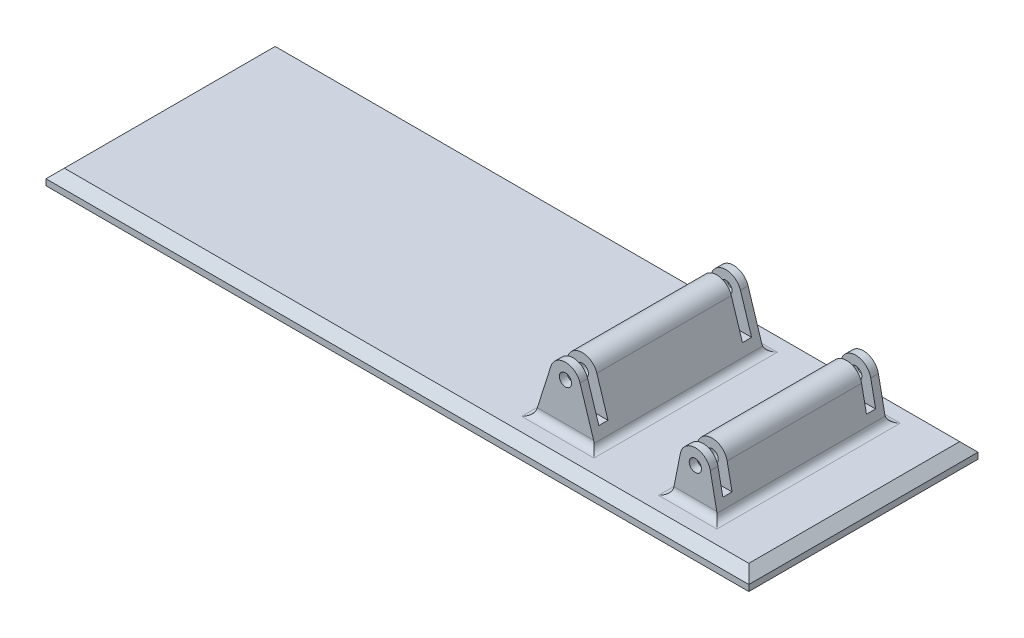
SolidWorks part; units mm, degrees
ref_plane "Front Plane" through (0, 0, 0) normal (0, 0, 1) x (1, 0, 0)
ref_plane "Top Plane" through (0, 0, 0) normal (0, 1, 0) x (1, 0, 0)
ref_plane "Right Plane" through (0, 0, 0) normal (1, 0, 0) x (0, 0, -1)
sketch "Sketch1" plane through (0, 0, 0) normal (0, 1, 0) x (1, 0, 0)
  line L0 (203.2, 69.85) -> (241.3, 69.85)
  line L1 (-292.1, -95.25) -> (292.1, -95.25)
  line L2 (-292.1, -95.25) -> (-292.1, 95.25)
  line L3 (-292.1, 95.25) -> (292.1, 95.25)
  line L4 (292.1, -95.25) -> (292.1, 95.25)
  line L5 (-292.1, -95.25) -> (292.1, 95.25) construction
  line L6 (-292.1, 95.25) -> (292.1, -95.25) construction
  line L7 (88.9, 69.85) -> (139.7, 69.85)
  line L8 (88.9, 69.85) -> (88.9, -69.85)
  line L9 (88.9, -69.85) -> (139.7, -69.85)
  line L10 (139.7, 69.85) -> (139.7, -69.85)
  line L11 (203.2, 69.85) -> (203.2, -69.85)
  line L12 (203.2, -69.85) -> (241.3, -69.85)
  line L13 (241.3, 69.85) -> (241.3, -69.85)
  point P0 (0, 0)
  dimension "D1" = 190.5
  dimension "D2" = 584.2
  dimension "D3" = 152.4
  dimension "D4" = 25.4
  dimension "D5" = 25.4
  dimension "D6" = 50.8
  dimension "D7" = 63.5
  dimension "D8" = 38.1
extrude "Base" add sketch "Sketch1" against normal blind 12.7 contours L1 L4 L3 L2 L7 L10 L9 L8 | L10 L7 L8 L9 | L13 L0 L11 L12
chamfer "Edge Chamfer" distance 7.62 angle 45 4 edges at (0, 0, -95.25) (292.1, 0, 0) (0, 0, 95.25) (-292.1, 0, 0)
sketch "Sketch2" plane through (0, 0, 0) normal (0, 0, 1) x (1, 0, 0)
  line L0 (114.3, 180.1955) -> (114.3, 0) construction
  line L1 (88.9, 0) -> (139.7, 0) construction
  line L2 (102.1937, 41.9376) -> (88.9, 0)
  line L3 (88.9, 0) -> (139.7, 0)
  line L4 (126.4063, 41.9376) -> (139.7, 0)
  line L5 (209.7968, 32.9716) -> (203.2, 0)
  line L6 (203.2, 0) -> (241.3, 0)
  line L7 (234.7032, 32.9716) -> (241.3, 0)
  line L8 (222.25, 0) -> (222.25, 72.4202) construction
  circle A0 centre (114.3, 38.1) radius 12.7
  circle A1 centre (222.25, 30.48) radius 12.7
  point P6 (114.3, 0)
  dimension "D1" = 25.4
  dimension "D2" = 38.1
  dimension "D4" = 30.48
  dimension "D3" = 50.8
extrude "Mounting Boss" add sketch "Sketch2" against normal up to vertex (69.85 mm away) and the other way up to vertex (69.85 mm away) contours L0 A0 L2 L3 | A0 L0 L3 L4 | A0 L0 | L0 A0 | A1 L5 L6 L7 | A1
fillet "Mounting Fillet" radius 6.35 8 edges at (114.3, 0, -69.85) (114.3, 0, 69.85) (139.7, 0, 0) (88.9, 0, 0) (222.25, 0, -69.85) (222.25, 0, 69.85) (241.3, 0, 0) (203.2, 0, 0)
sketch "Sketch3" plane through (0, 0, 0) normal (1, 0, 0) x (0, 0, -1)
  line L0 (0, 50.8) -> (0, 12.7) construction
  line L1 (63.5, 12.7) -> (-63.5, 12.7)
  line L2 (63.5, 12.7) -> (63.5, 50.8)
  line L3 (63.5, 50.8) -> (-63.5, 50.8)
  line L4 (-63.5, 12.7) -> (-63.5, 50.8)
  line L5 (63.5, 12.7) -> (-63.5, 50.8) construction
  line L6 (63.5, 50.8) -> (-63.5, 12.7) construction
  line L7 (69.85, 50.8) -> (-69.85, 50.8) construction
  line L8 (-69.85, 41.9376) -> (-69.85, 6.35) construction
  line L9 (-55.88, 50.8) -> (-55.88, 12.7)
  line L10 (55.88, 50.8) -> (55.88, 12.7)
  line L11 (-95.25, 0) -> (95.25, 0) construction
  point P0 (0, 31.75)
  dimension "D1" = 6.35
  dimension "D2" = 7.62
  dimension "D3" = 12.7
extrude "Support Cut" cut sketch "Sketch3" along normal through all contours L9 L3 L4 L1 | L3 L10 L1 L2
sketch "Sketch4" plane through (0, 0, 0) normal (0, 0, 1) x (1, 0, 0)
  circle A0 centre (114.3, 38.1) radius 5.08
  arc A2 (126.4063, 41.9376) -> (102.1937, 41.9376) centre (114.3, 38.1) ccw construction
  circle A3 centre (222.25, 30.48) radius 5.08
  arc A4 (234.7032, 32.9716) -> (209.7968, 32.9716) centre (222.25, 30.48) ccw construction
  dimension "D1" = 10.16
extrude "Pin Cut" cut sketch "Sketch4" against normal through all and the other way through all
